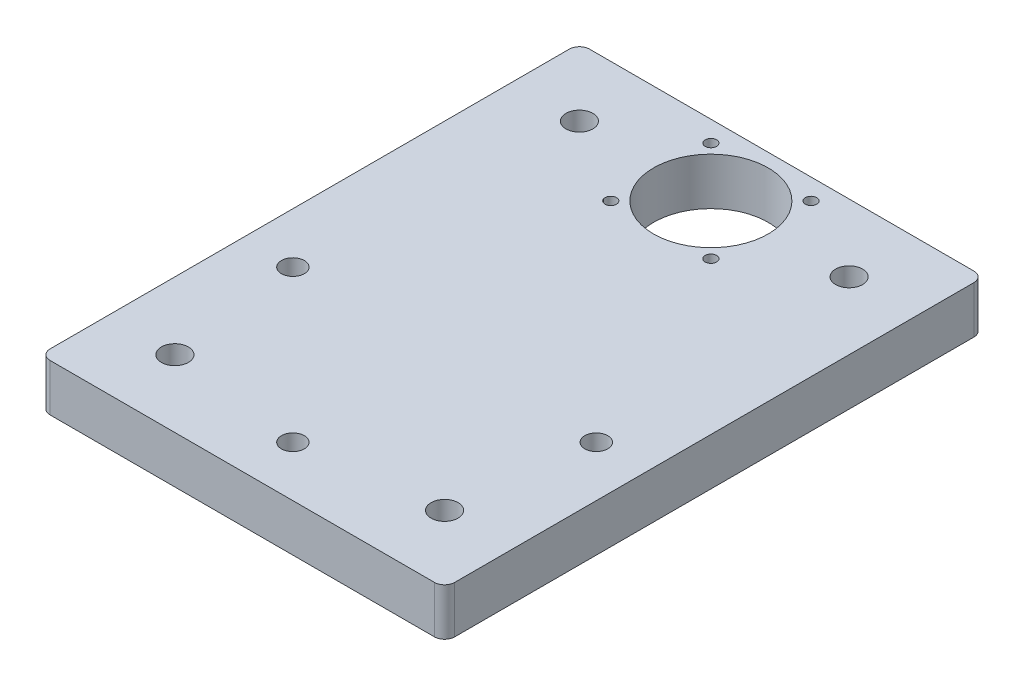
SolidWorks part; units mm, degrees
ref_plane "前视基准面" through (0, 0, 0) normal (0, 0, 1) x (1, 0, 0)
ref_plane "上视基准面" through (0, 0, 0) normal (0, 1, 0) x (1, 0, 0)
ref_plane "右视基准面" through (0, 0, 0) normal (1, 0, 0) x (0, 0, -1)
other "Configuration Table"
sketch "草图1" plane through (0, 0, 0) normal (0, 1, 0) x (1, 0, 0)
  line L0 (0, 60) -> (0, -100) construction
  line L1 (-57, -100) -> (57, -100)
  line L2 (-60, -97) -> (-60, 57)
  line L3 (-57, 60) -> (57, 60)
  line L4 (60, -97) -> (60, 57)
  line L5 (-60, -100) -> (60, 60) construction
  line L6 (-60, 60) -> (60, -100) construction
  line L7 (60, -20) -> (-60, -20) construction
  arc A0 (-57, -100) -> (-60, -97) centre (-57, -97) cw
  arc A1 (57, -100) -> (60, -97) centre (57, -97) ccw
  arc A2 (57, 60) -> (60, 57) centre (57, 57) cw
  arc A3 (-60, 57) -> (-57, 60) centre (-57, 57) cw
  dimension "D3" = 3
  dimension "D1" = 120
  dimension "D2" = 160
extrude "凸台-拉伸1" add sketch "草图1" along normal blind 14
sketch "草图3" plane through (0, 0, 0) normal (0, -1, 0) x (1, 0, 0)
  line L1 (57, -60) -> (-57, -60) construction
  line L2 (60, 97) -> (60, -57) construction
  circle A0 centre (14.8492, -24.1508) radius 1.7
  circle A1 centre (14.8492, -53.8492) radius 1.7
  circle A2 centre (-14.8492, -53.8492) radius 1.7
  circle A3 centre (-14.8492, -24.1508) radius 1.7
  dimension "D1" = 3.4
  dimension "D2" = 3.4
  dimension "D3" = 3.4
  dimension "D4" = 3.4
  dimension "D5" = 29.6985
  dimension "D6" = 29.6985
  dimension "D7" = 29.6985
  dimension "D8" = 29.6985
  dimension "D9" = 6.1508
  dimension "D10" = 45.1508
  dimension "D11" = 6.1508
  dimension "D12" = 45.1508
extrude "切除-拉伸1" cut sketch "草图3" against normal through all
sketch "草图4" plane through (0, 0, 0) normal (0, -1, 0) x (1, 0, 0)
  line L0 (-57, 100) -> (57, 100) construction
  line L3 (60, 97) -> (60, -57) construction
  line L6 (-60, -57) -> (-60, 97) construction
  circle A0 centre (0, 85) radius 3.4
  circle A1 centre (45, 40) radius 3.4
  circle A2 centre (-45, 40) radius 3.4
  dimension "D1" = 6.8
  dimension "D2" = 6.8
  dimension "D3" = 6.8
  dimension "D4" = 15
  dimension "D5" = 15
  dimension "D6" = 15
extrude "切除-拉伸2" cut sketch "草图4" against normal through all
sketch "草图5" plane through (0, 14, 0) normal (0, 1, 0) x (1, 0, 0)
  circle A0 centre (0, 39) radius 17
  dimension "D1" = 34
extrude "切除-拉伸3" cut sketch "草图5" against normal through all
sketch "草图6" plane through (0, 0, 0) normal (0, -1, 0) x (1, 0, 0)
  line L0 (0, 100) -> (0, -60) construction
  line L1 (-57, 100) -> (57, 100) construction
  line L2 (57, -60) -> (-57, -60) construction
  line L3 (60, 20) -> (-60, 20) construction
  line L4 (60, 97) -> (60, -57) construction
  line L5 (-60, -57) -> (-60, 97) construction
  circle A0 centre (40, 80) radius 4
  circle A1 centre (-40, 80) radius 4
  circle A2 centre (40, -40) radius 4
  circle A3 centre (-40, -40) radius 4
  dimension "D1" = 8
  dimension "D2" = 20
  dimension "D3" = 20
extrude "切除-拉伸4" cut sketch "草图6" against normal through all
